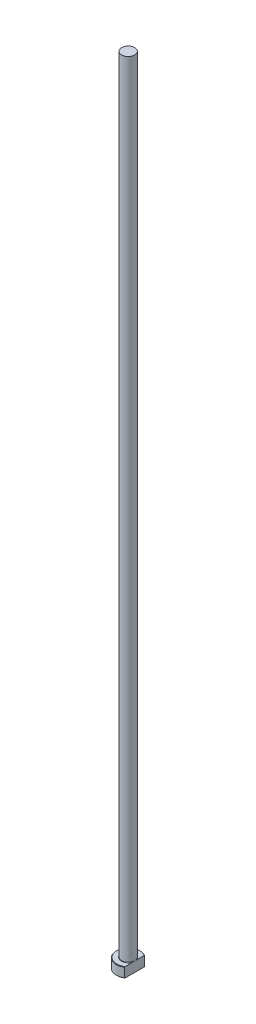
SolidWorks part; units mm, degrees
ref_plane "Front Plane" through (0, 0, 0) normal (0, 0, 1) x (1, 0, 0)
ref_plane "Top Plane" through (0, 0, 0) normal (0, 1, 0) x (1, 0, 0)
ref_plane "Right Plane" through (0, 0, 0) normal (1, 0, 0) x (0, 0, -1)
sketch "Sketch1" plane through (0, 0, 0) normal (0, 0, 1) x (1, 0, 0)
  line L0 (0, 259.9588) -> (0, -15.1925) construction
  line L1 (0, 0) -> (-6, 0)
  line L2 (-6, 0) -> (-6, 5)
  line L3 (-6, 5) -> (-3.25, 5)
  line L4 (-3.25, 5) -> (-3.25, 400)
  line L5 (-3.25, 400) -> (0, 400)
  line L6 (0, 400) -> (0, 0)
  dimension "L" = 400
  dimension "H" = 12
  dimension "T" = 5
  dimension "D" = 6.5
revolve "Revolve1" add sketch "Sketch1" angle 360 about L0
chamfer "Chamfer1" distance 0.2 angle 45 2 edges at (0, 5, 6) (0, 0, 6)
fillet "Fillet1" radius 0.2 1 edges at (0, 5, 3.25)
sketch "Sketch2" plane through (0, 0, 0) normal (0, 1, 0) x (1, 0, 0)
  line L0 (3.25, 5.0436) -> (3.25, -5.0436)
  circle A0 centre (0, 0) radius 6 construction
  arc A1 (3.25, -5.0436) -> (3.25, 5.0436) centre (0, 0) ccw
  circle A2 centre (0, 0) radius 3.25 construction
extrude "KEY" cut sketch "Sketch2" along normal through all
